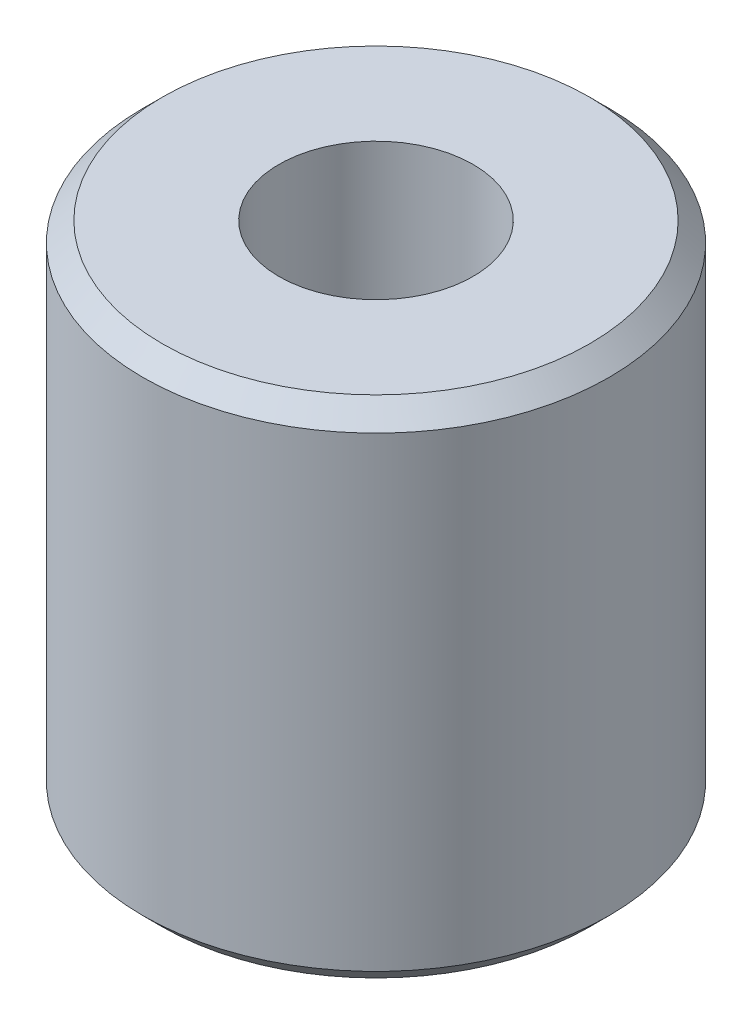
SolidWorks part; units mm, degrees
ref_plane "Plan de face" through (0, 0, 0) normal (0, 0, 1) x (1, 0, 0)
ref_plane "Plan de dessus" through (0, 0, 0) normal (0, 1, 0) x (1, 0, 0)
ref_plane "Plan de droite" through (0, 0, 0) normal (1, 0, 0) x (0, 0, -1)
ref_plane "Plan1" through (0, 0, 0) normal (0, 0, -1) x (-1, 0, 0)
sketch "Esquisse1" plane through (0, 0, 0) normal (0, 0, -1) x (-1, 0, 0)
  line L0 (-5.5, -6.5) -> (-2.5, -6.5)
  line L1 (-2.5, -6.5) -> (-2.5, 6.5)
  line L2 (-2.5, 6.5) -> (-5.5, 6.5)
  line L3 (-5.5, 6.5) -> (-6, 6)
  line L4 (-6, 6) -> (-6, -6)
  line L5 (-6, -6) -> (-5.5, -6.5)
  line L6 (0, -6.5) -> (0, 6.5) construction
revolve "Révolution1" add sketch "Esquisse1" angle 360 about L6
